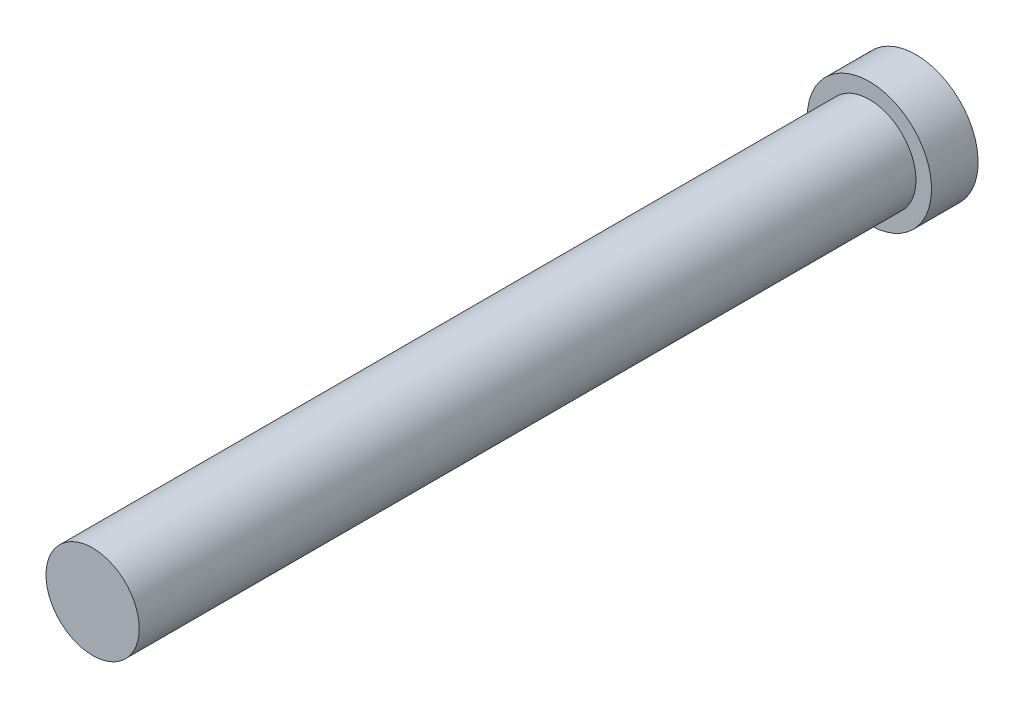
SolidWorks part; units mm, degrees
ref_plane "前视" through (0, 0, 0) normal (0, 0, 1) x (1, 0, 0)
ref_plane "上视" through (0, 0, 0) normal (0, 1, 0) x (1, 0, 0)
ref_plane "右视" through (0, 0, 0) normal (1, 0, 0) x (0, 0, -1)
sketch "草图1" plane through (0, 0, 0) normal (0, 0, 1) x (1, 0, 0)
  circle A0 centre (0, 0) radius 1.5
extrude "凸台-拉伸1" add sketch "草图1" along normal blind 25
sketch "草图2" plane through (0, 0, 0) normal (0, 0, -1) x (-1, 0, 0)
  circle A0 centre (0, 0) radius 2
extrude "凸台-拉伸2" add sketch "草图2" along normal blind 1.5
sketch "草图3" plane through (0, 0, -1.5) normal (0, 0, -1) x (-1, 0, 0)
  line L0 (-0.2968, 0.305) -> (-1.7357, 0.305)
  line L1 (1.7357, -0.305) -> (0.2968, -0.305)
  line L2 (1.7357, -0.305) -> (1.7357, 0.305)
  line L3 (1.7357, 0.305) -> (0.2968, 0.305)
  line L4 (-1.7357, -0.305) -> (-1.7357, 0.305)
  line L5 (1.7357, -0.305) -> (-1.7357, 0.305) construction
  line L6 (1.7357, 0.305) -> (-1.7357, -0.305) construction
  line L7 (0.2968, -1.689) -> (-0.2968, -1.689)
  line L8 (0.2968, -1.689) -> (0.2968, -0.305)
  line L9 (0.2968, 1.689) -> (-0.2968, 1.689)
  line L10 (-0.2968, -1.689) -> (-0.2968, -0.305)
  line L11 (0.2968, -1.689) -> (-0.2968, 1.689) construction
  line L12 (0.2968, 1.689) -> (-0.2968, -1.689) construction
  line L13 (-0.2968, 0.305) -> (-0.2968, 1.689)
  line L14 (-0.2968, -0.305) -> (-1.7357, -0.305)
  line L15 (0.2968, 0.305) -> (0.2968, 1.689)
  point P0 (0, 0)
  point P6 (0, 0)
extrude "切除-拉伸1" cut sketch "草图3" against normal blind 1
